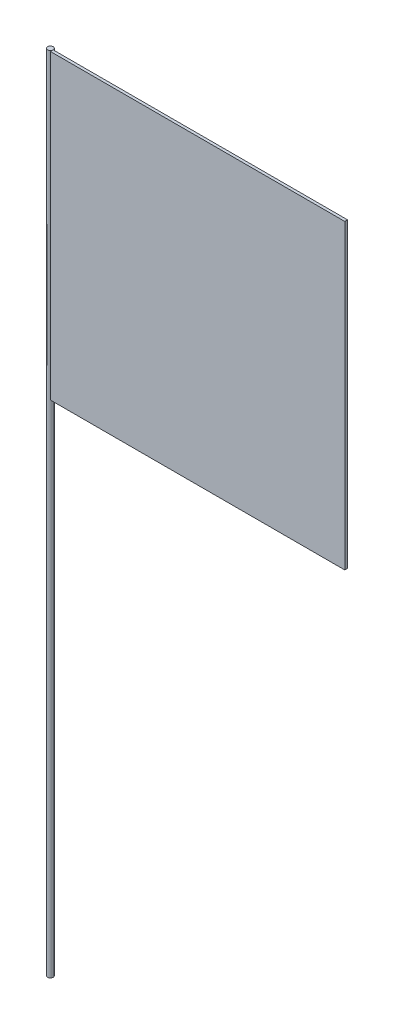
SolidWorks part; units mm, degrees
ref_plane "Front Plane" through (0, 0, 0) normal (0, 0, 1) x (1, 0, 0)
ref_plane "Top Plane" through (0, 0, 0) normal (0, 1, 0) x (1, 0, 0)
ref_plane "Right Plane" through (0, 0, 0) normal (1, 0, 0) x (0, 0, -1)
sketch "Sketch1" plane through (0, 0, 0) normal (0, 1, 0) x (1, 0, 0)
  circle A0 centre (0, 0) radius 0.5
  dimension "D1" = 1
extrude "Boss-Extrude1" add sketch "Sketch1" along normal blind 145
sketch "Sketch3" plane through (0, 0, 0) normal (0, 0, 1) x (1, 0, 0)
  line L1 (0.5, 145) -> (53.6392, 145)
  line L2 (0.5, 145) -> (0.5, 90.5062)
  line L3 (0.5, 90.5062) -> (53.6392, 90.5062)
  line L4 (53.6392, 145) -> (53.6392, 90.5062)
  dimension "D1" = 54.4938
  dimension "D2" = 53.1392
extrude "Boss-Extrude3" add sketch "Sketch3" along normal blind 0.5 separate body
